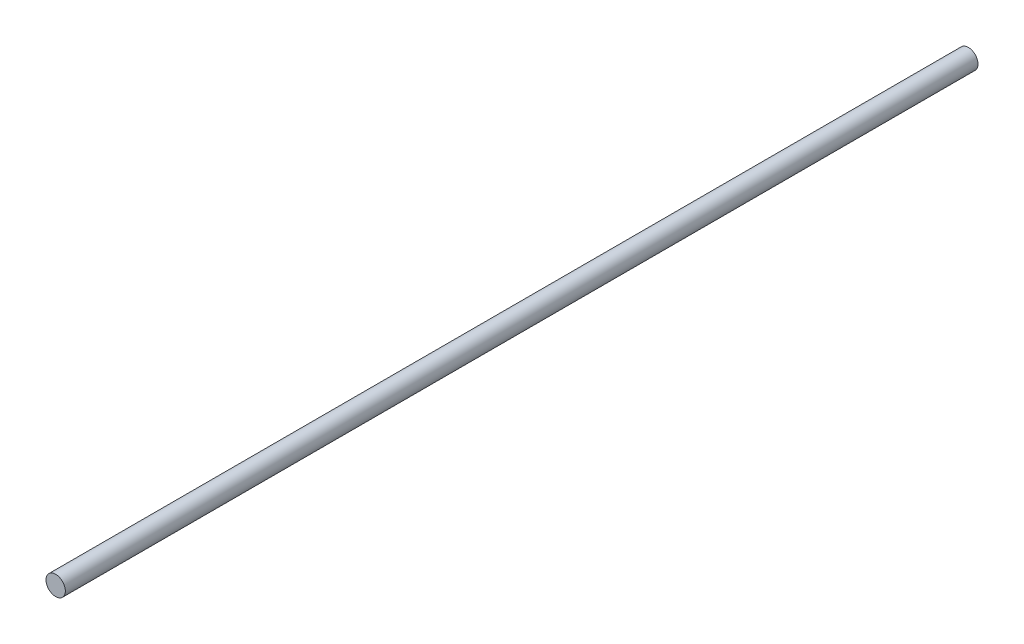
SolidWorks part; units mm, degrees
ref_plane "Спереди" through (0, 0, 0) normal (0, 0, 1) x (1, 0, 0)
ref_plane "Сверху" through (0, 0, 0) normal (0, 1, 0) x (1, 0, 0)
ref_plane "Справа" through (0, 0, 0) normal (1, 0, 0) x (0, 0, -1)
sketch "Эскиз1" plane through (0, 0, 0) normal (0, 0, 1) x (1, 0, 0)
  circle A0 centre (0, 0) radius 4
  dimension "D1" = 8
extrude "Бобышка-Вытянуть1" add sketch "Эскиз1" along normal blind 377
